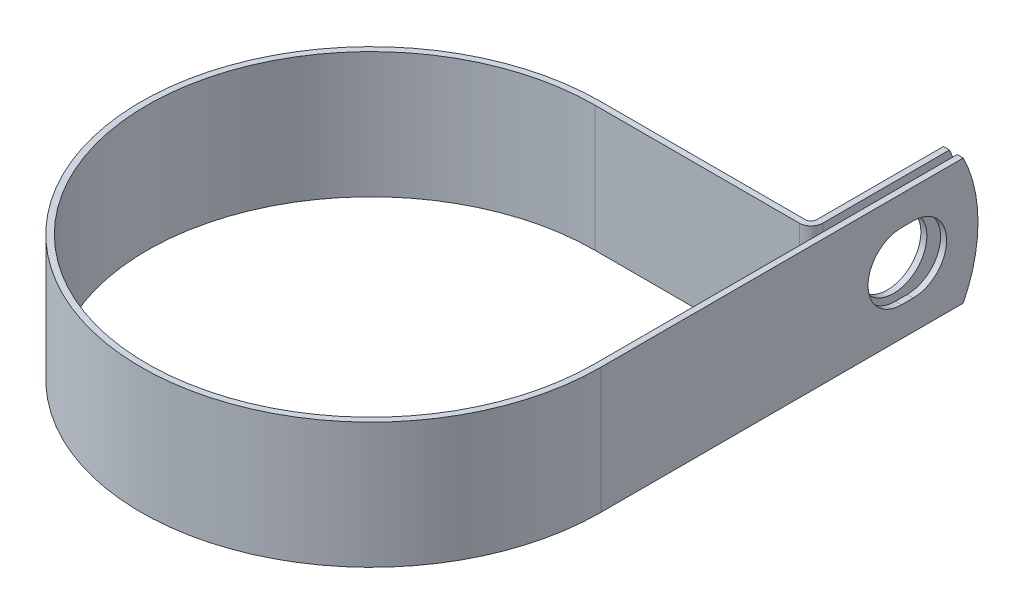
SolidWorks part; units mm, degrees
ref_plane "Front Plane" through (0, 0, 0) normal (0, 0, 1) x (1, 0, 0)
ref_plane "Top Plane" through (0, 0, 0) normal (0, 1, 0) x (1, 0, 0)
ref_plane "Right Plane" through (0, 0, 0) normal (1, 0, 0) x (0, 0, -1)
sketch "Sketch1" plane through (0, 0, 0) normal (0, 1, 0) x (1, 0, 0)
  line L0 (0, 45.2374) -> (41.2852, 45.2374)
  line L1 (45.2374, 0) -> (45.2374, 45.2374)
  line L2 (43.6626, 76.1746) -> (43.6626, 47.6148)
  line L5 (45.2374, 45.2374) -> (45.2374, 76.1746)
  arc A0 (0, 45.2374) -> (45.2374, 0) centre (0, 0) ccw
  arc A3 (41.2852, 45.2374) -> (43.6626, 47.6148) centre (41.2852, 47.6148) ccw
extrude "Extrude-Thin1" add sketch "Sketch1" along normal mid plane 25.4 thin
sketch "Sketch2" plane through (42.4434, 0, 0) normal (-1, 0, 0) x (0, 0, 1)
  line L0 (-76.1746, 12.7) -> (-76.1746, -12.7) construction
  line L7 (0, 12.7) -> (0, -12.7) construction
  circle A0 centre (-61.8998, 0) radius 6.7437
  point P2 (-76.1746, 0)
extrude "Cut-Extrude1" cut sketch "Sketch2" against normal up to surface (1.2192 mm away)
sketch "Sketch3" plane through (46.4566, 0, 0) normal (1, 0, 0) x (0, 0, -1)
  line L0 (60.706, 0) -> (63.0936, 0) construction
  line L1 (60.706, 6.7437) -> (63.0936, 6.7437)
  line L2 (60.706, -6.7437) -> (63.0936, -6.7437)
  line L3 (76.1746, 12.7) -> (76.1746, -12.7) construction
  arc A0 (60.706, 6.7437) -> (60.706, -6.7437) centre (60.706, 0) ccw
  arc A1 (63.0936, -6.7437) -> (63.0936, 6.7437) centre (63.0936, 0) ccw
  point P3 (61.8998, 0)
  point P8 (76.1746, 0)
  point P11 (53.9623, 0)
  point P12 (69.8373, 0)
extrude "Cut-Extrude2" cut sketch "Sketch3" against normal up to surface (1.2192 mm away)
sketch "Sketch4" plane through (42.4434, 0, 0) normal (-1, 0, 0) x (0, 0, 1)
  line L0 (-76.1746, 12.7) -> (-76.1746, -12.7)
  line L1 (-76.1746, 12.7) -> (-73.1973, 12.7)
  line L2 (-76.1746, 12.7) -> (-47.6148, 12.7) construction
  line L3 (-76.1746, -12.7) -> (-73.1973, -12.7)
  line L4 (-76.1746, -12.7) -> (-47.6148, -12.7) construction
  arc A0 (-73.1973, 12.7) -> (-73.1973, -12.7) centre (-47.5996, 0) ccw
extrude "Cut-Extrude3" cut sketch "Sketch4" against normal through all contours A0 M4 M5 | A0 L0 M2
equation "\"D1@Sketch3\" = \"D2@Sketch2\""
equation "\"D7@Sketch1\" = \"D3@Sketch2\" + \"D1@Sketch3\""
equation "\"D1@Sketch4\" = ( \"D1@Extrude-Thin1\" + .125 ) * 2"
equation "\"D2@Sketch1\"=1.95*\"D5@Extrude-Thin1\""
equation "\"D2@Sketch3\" = \"D1@Sketch2\""
